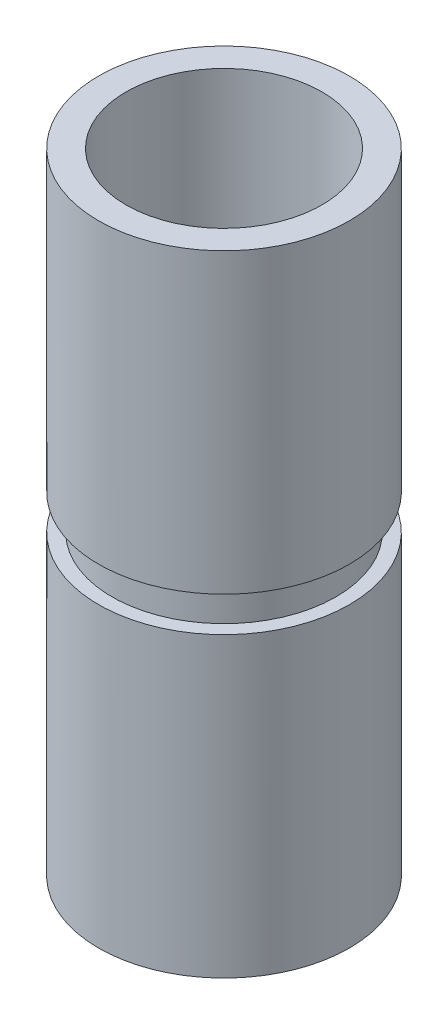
SolidWorks part; units mm, degrees
ref_plane "Front Plane" through (0, 0, 0) normal (0, 0, 1) x (1, 0, 0)
ref_plane "Top Plane" through (0, 0, 0) normal (0, 1, 0) x (1, 0, 0)
ref_plane "Right Plane" through (0, 0, 0) normal (1, 0, 0) x (0, 0, -1)
sketch "Sketch1" plane through (0, 0, 0) normal (0, 1, 0) x (1, 0, 0)
  circle A1 centre (0, 0) radius 22.7584
  circle A2 centre (0, 0) radius 17.78
  dimension "D1" = 35.56
  dimension "D2" = 4.9784
ref_plane "Plane1" through (0, 57.15, 0) normal (0, -1, 0) x (-1, 0, 0)
extrude "Boss-Extrude4" add sketch "Sketch1" along normal blind 114.3
sketch "Sketch17" plane through (0, 57.15, 0) normal (0, -1, 0) x (-1, 0, 0)
  circle A0 centre (0, 0) radius 22.86
  circle A1 centre (0, 0) radius 20.32
  dimension "D1" = 2.54
  dimension "D2" = 40.64
extrude "Cut-Extrude3" cut sketch "Sketch17" against normal mid plane 6.35
